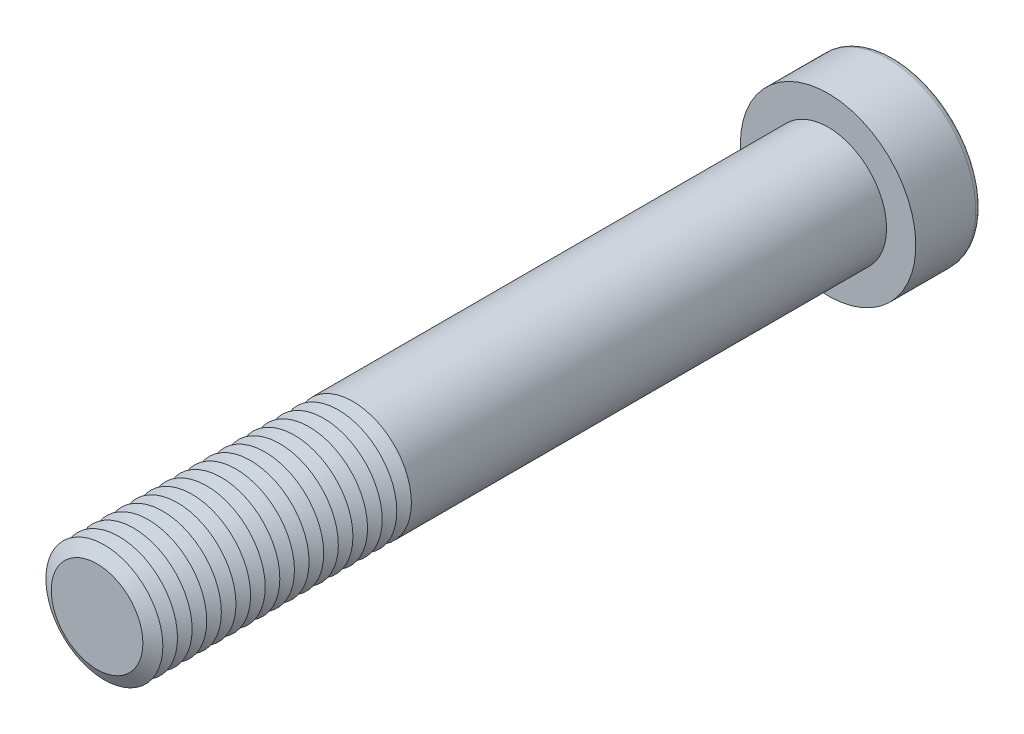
SolidWorks part; units mm, degrees
ref_plane "Front Plane" through (0, 0, 0) normal (0, 0, 1) x (1, 0, 0)
ref_plane "Top Plane" through (0, 0, 0) normal (0, 1, 0) x (1, 0, 0)
ref_plane "Right Plane" through (0, 0, 0) normal (1, 0, 0) x (0, 0, -1)
sketch "Sketch1" plane through (0, 0, 0) normal (0, 0, 1) x (1, 0, 0)
  circle A0 centre (0, 0) radius 8
  dimension "D1" = 16
extrude "Boss-Extrude1" add sketch "Sketch1" along normal blind 100
sketch "Sketch2" plane through (0, 0, 0) normal (0, 0, -1) x (-1, 0, 0)
  circle A0 centre (0, 0) radius 12
  dimension "D1" = 24
extrude "Boss-Extrude2" add sketch "Sketch2" along normal blind 9
sketch "Sketch3" plane through (0, 0, -9) normal (0, 0, -1) x (-1, 0, 0)
  line L1 (-3.4641, 6) -> (-6.9282, 0)
  line L2 (-6.9282, 0) -> (-3.4641, -6)
  line L3 (-3.4641, -6) -> (3.4641, -6)
  line L4 (3.4641, -6) -> (6.9282, 0)
  line L5 (6.9282, 0) -> (3.4641, 6)
  line L6 (3.4641, 6) -> (-3.4641, 6)
  circle A0 centre (0, 0) radius 6 construction
  dimension "D1" = 12
extrude "Cut-Extrude1" cut sketch "Sketch3" against normal blind 9
fillet "Fillet1" radius 0.8 1 edges at (-12, 0, -9)
sketch "Sketch4" plane through (0, 0, 0) normal (0, 0, -1) x (-1, 0, 0)
  line L0 (3.4641, -6) -> (6.9282, 0) construction
  circle A0 centre (0, 0) radius 6
extrude "Cut-Extrude2" cut sketch "Sketch4" against normal through all draft 60
sketch "Sketch5" plane through (0, 0, -9) normal (0, 0, -1) x (-1, 0, 0)
  circle A0 centre (0, 0) radius 6.9282
extrude "Cut-Extrude3" cut sketch "Sketch5" against normal through all draft 75
sketch "Sketch7" plane through (0, 0, 0) normal (1, 0, 0) x (0, 0, -1)
  line L25 (-100, 6.2679) -> (-99, 8)
  line L26 (-100, 8) -> (-100, -8) construction
  line L27 (-99, 8) -> (-101, 8)
  line L28 (-101, 8) -> (-100, 6.2679)
  line L29 (0, 8) -> (-100, 8) construction
  dimension "D1" = 2
revolve "Cut-Revolve1" cut sketch "Sketch7" angle 360 about axis through (0, 0, 100) along (0, 0, -1)
pattern_linear "LPattern1" count 18 spacing 2 along (0, 0, -1) of "Cut-Revolve1"
